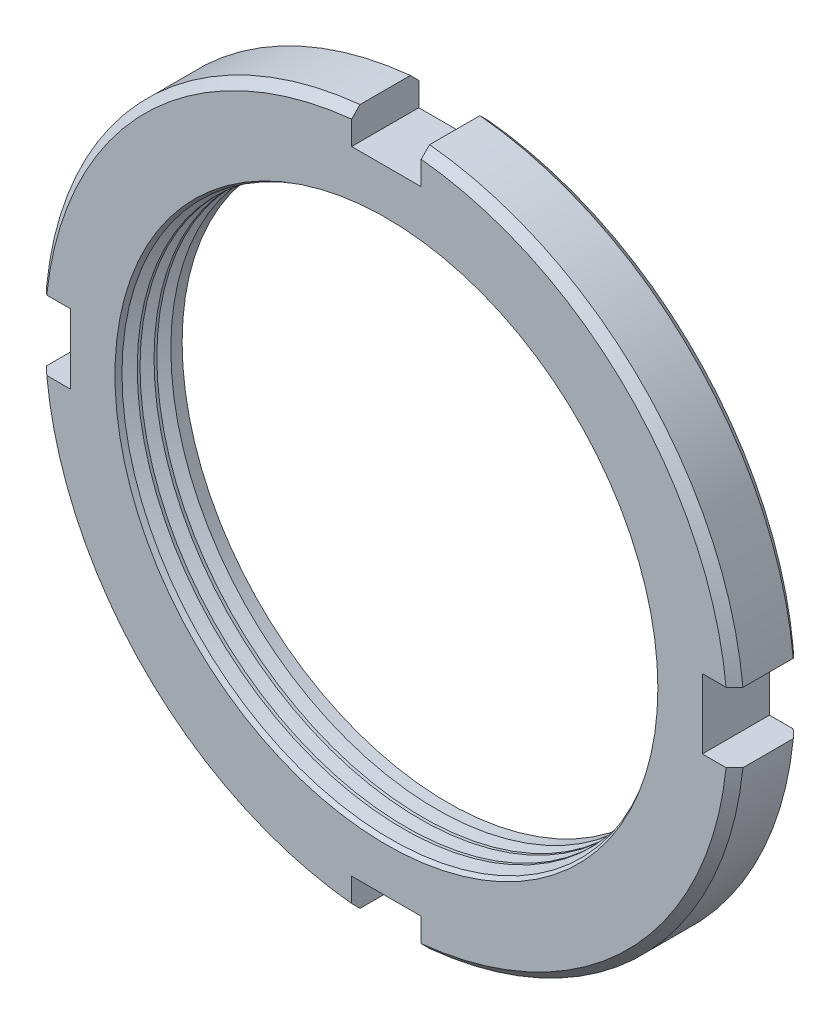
SolidWorks part; units mm, degrees
ref_plane "Front" through (0, 0, 0) normal (0, 0, 1) x (1, 0, 0)
ref_plane "Top" through (0, 0, 0) normal (0, 1, 0) x (1, 0, 0)
ref_plane "Right" through (0, 0, 0) normal (1, 0, 0) x (0, 0, -1)
sketch "Sketch2" plane through (0, 0, 0) normal (0, 0, 1) x (1, 0, 0)
  circle A0 centre (0, 0) radius 62.5
  dimension "dk" = 125
extrude "BaseNut" add sketch "Sketch2" against normal blind 12
chamfer "Chamfer1" distance 1.5 angle 45 2 edges at (62.5, 0, -12) (62.5, 0, 0)
sketch "Sketch3" plane through (-17.5617, 31.6827, 0) normal (0, 0, 1) x (1, 0, 0)
  circle A0 centre (17.5617, -31.6827) radius 47.5
  circle A1 centre (17.5617, -31.6827) radius 61 construction
  dimension "D1" = 95
extrude "Hole" cut sketch "Sketch3" against normal through all
chamfer "EndChamfer" distance 1 angle 60 2 edges at (47.5, 0, 0) (47.5, 0, -12)
sketch "Sketch4" plane through (-28.8484, 49.2663, 0) normal (0, 0, 1) x (1, 0, 0)
  line L0 (28.8484, 68.6571) -> (28.8484, -68.9081) construction
  line L2 (22.6334, 12.9239) -> (35.0634, 12.9239) construction
  line L3 (22.6334, 12.9239) -> (22.6334, 7.1739)
  line L4 (22.6334, 7.1739) -> (35.0634, 7.1739)
  line L5 (35.0634, 12.9239) -> (35.0634, 7.1739)
  arc A1 (35.0634, 12.9239) -> (22.6334, 12.9239) centre (28.8484, -49.2663) ccw
  circle A2 centre (28.8484, -49.2663) radius 62.5 construction
  dimension "n" = 12.43
  dimension "t" = 5.75
extrude "SlotCut" cut sketch "Sketch4" against normal through all
pattern_circular "SlotPat" count 4 over 360 about axis through (0, 0, 0) along (0, 0, 1) of "SlotCut"
sketch "Sketch5" plane through (0, 0, 0) normal (0, 1, 0) x (1, 0, 0)
  line L0 (45, 2.9821) -> (45, 0.4821)
  line L1 (45, 0.4821) -> (47.5, 0.4821)
  line L2 (47.5, 0.4821) -> (49.6651, 1.7321)
  line L3 (49.6651, 1.7321) -> (47.5, 2.9821)
  line L4 (47.5, 2.9821) -> (45, 2.9821)
  line L5 (0, 37.3018) -> (0, -33.5096) construction
  line L9 (47.5, 1.7321) -> (-47.5, 1.7321) construction
  dimension "D1" = 2.5
  dimension "D2" = 95
revolve "Cut-Revolve10" cut sketch "Sketch5" angle 360 about L5
pattern_linear "LPattern10" count 3 spacing 3 along (0, 0, -1) of "Cut-Revolve10"
equation "\"D1@Sketch5\" =  ( \"D2@ThreadCosmetic1\" - \"D1@Sketch3\" )  / 2"
equation "\"D3@LPattern10\" = \"D1@Sketch5\" * 1.2"
equation "\"D1@LPattern10\" = \"m@BaseNut\" / \"D3@LPattern10\"-1"
equation "\"D2@Sketch5\" = \"D1@Sketch3\""
